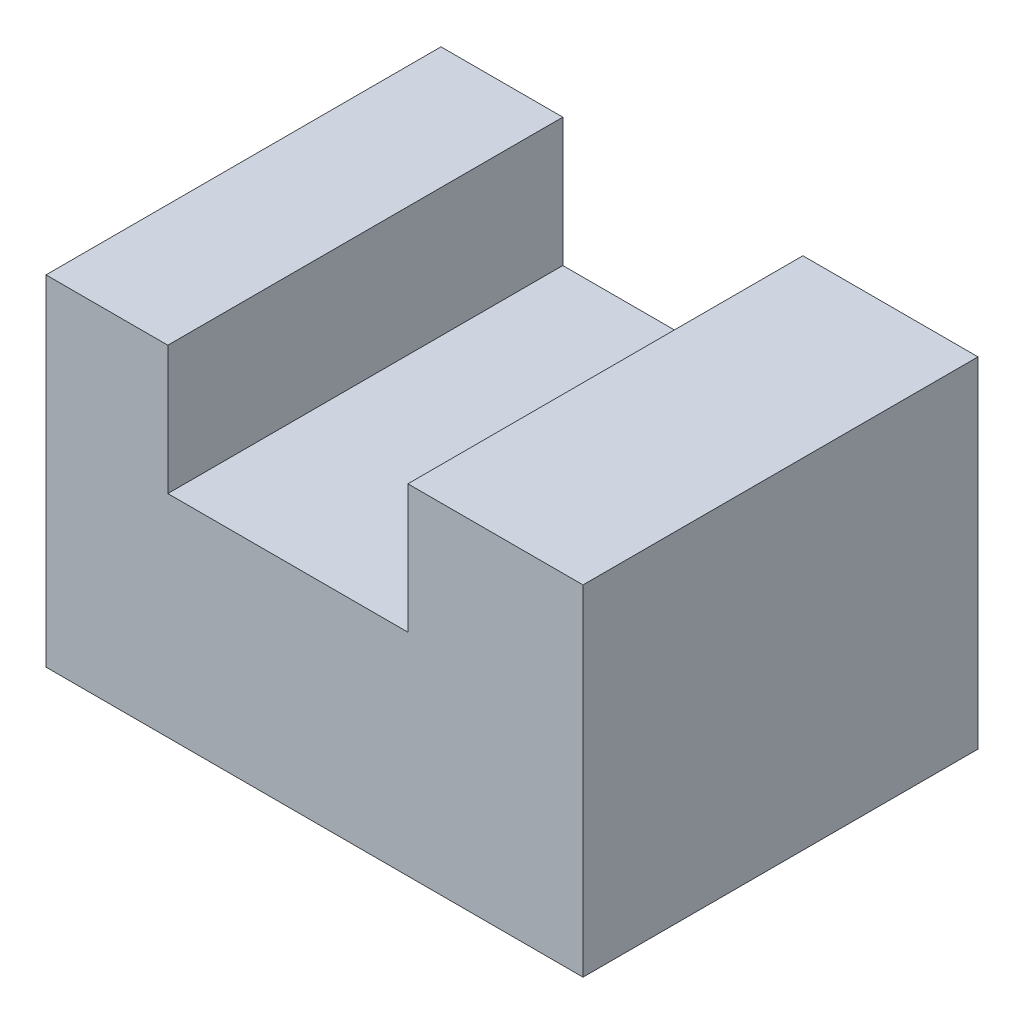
SolidWorks part; units mm, degrees
ref_plane "正面" through (0, 0, 0) normal (0, 0, 1) x (1, 0, 0)
ref_plane "平面" through (0, 0, 0) normal (0, 1, 0) x (1, 0, 0)
ref_plane "右側面" through (0, 0, 0) normal (1, 0, 0) x (0, 0, -1)
sketch "ｽｹｯﾁ1" plane through (0, 0, 0) normal (0, 1, 0) x (1, 0, 0)
  line L1 (1.391, 0) -> (53.5539, 0)
  line L2 (1.391, 0) -> (1.391, 38.3687)
  line L3 (1.391, 38.3687) -> (53.5539, 38.3687)
  line L4 (53.5539, 0) -> (53.5539, 38.3687)
extrude "ﾎﾞｽ - 押し出し1" add sketch "ｽｹｯﾁ1" along normal blind 33
sketch "ｽｹｯﾁ2" plane through (0, 0, 0) normal (0, 0, 1) x (1, 0, 0)
  line L0 (1.391, 33) -> (53.5539, 33) construction
  line L1 (13.2252, 33) -> (36.5437, 33)
  line L2 (13.2252, 33) -> (13.2252, 20.5189)
  line L3 (13.2252, 20.5189) -> (36.5437, 20.5189)
  line L4 (36.5437, 33) -> (36.5437, 20.5189)
extrude "ｶｯﾄ - 押し出し1" cut sketch "ｽｹｯﾁ2" against normal blind 43
